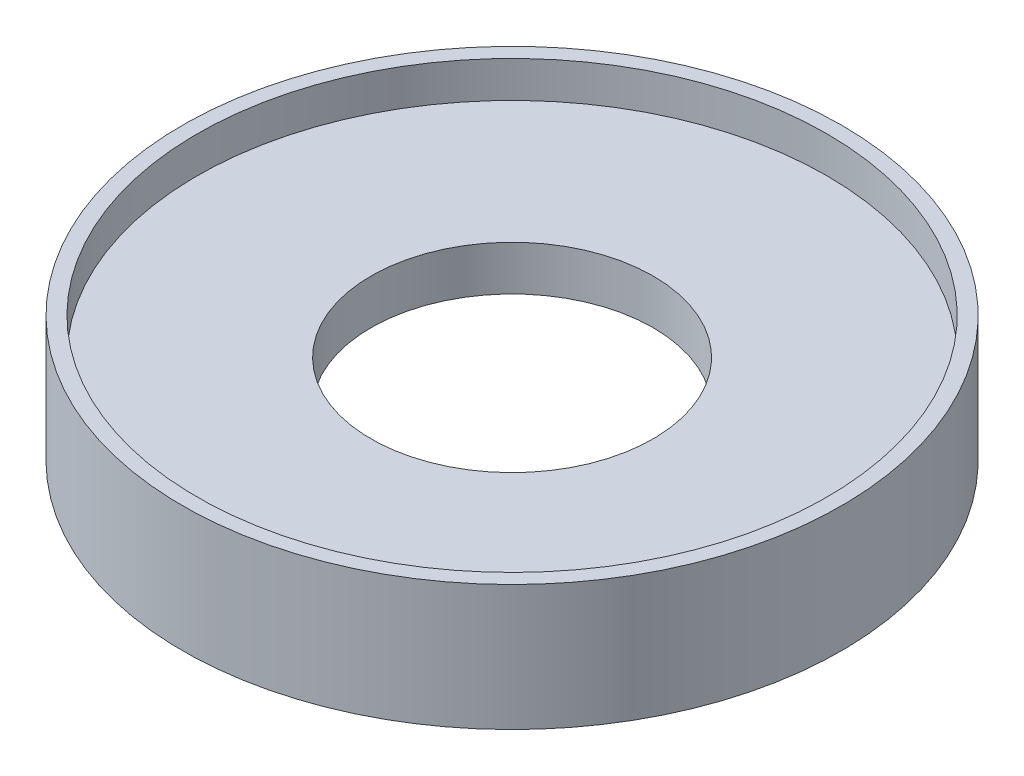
SolidWorks part; units mm, degrees
ref_plane "Front Plane" through (0, 0, 0) normal (0, 0, 1) x (1, 0, 0)
ref_plane "Top Plane" through (0, 0, 0) normal (0, 1, 0) x (1, 0, 0)
ref_plane "Right Plane" through (0, 0, 0) normal (1, 0, 0) x (0, 0, -1)
sketch "Sketch1" plane through (0, 0, 0) normal (1, 0, 0) x (0, 0, -1)
  line L0 (19.05, 0) -> (42.5, 0)
  line L1 (42.5, 0) -> (42.5, -6)
  line L2 (42.5, -6) -> (44.5, -6)
  line L3 (44.5, -6) -> (44.5, 10.96)
  line L4 (44.5, 10.96) -> (42.5, 10.96)
  line L5 (42.5, 10.96) -> (42.5, 6.05)
  line L6 (42.5, 6.05) -> (19.05, 6.05)
  line L7 (19.05, 6.05) -> (19.05, 0)
  line L8 (0, 0) -> (0, 47.8452) construction
  dimension "D1" = 89
  dimension "D2" = 38.1
  dimension "D3" = 85
  dimension "D4" = 6
  dimension "D5" = 6.05
  dimension "D6" = 16.96
revolve "Revolve1" add sketch "Sketch1" angle 360 about L8
ref_point "Point1"
